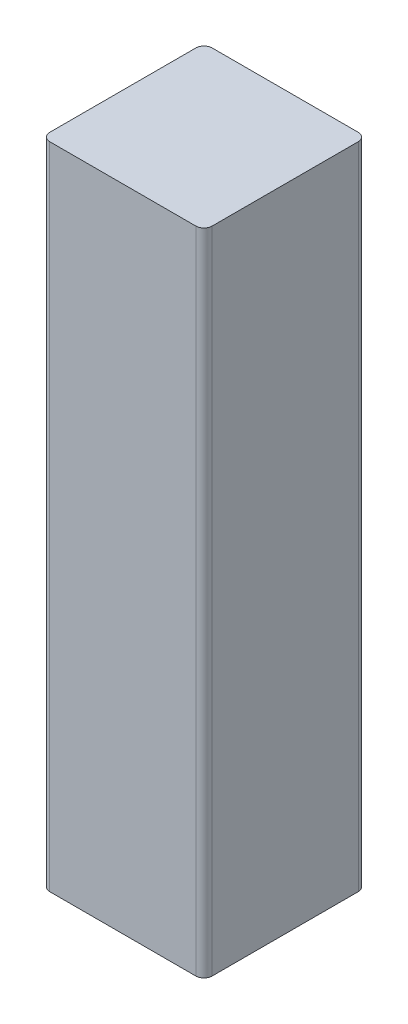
SolidWorks part; units mm, degrees
ref_plane "Plan de face" through (0, 0, 0) normal (0, 0, 1) x (1, 0, 0)
ref_plane "Plan de dessus" through (0, 0, 0) normal (0, 1, 0) x (1, 0, 0)
ref_plane "Plan de droite" through (0, 0, 0) normal (1, 0, 0) x (0, 0, -1)
ref_plane "Plan1" through (0, 20, 0) normal (0, 1, 0) x (1, 0, 0)
sketch "Esquisse1" plane through (0, 20, 0) normal (0, 1, 0) x (1, 0, 0)
  line L0 (-4.5, -5) -> (4.5, -5)
  line L1 (5, -4.5) -> (5, 4.5)
  line L2 (4.5, 5) -> (-4.5, 5)
  line L3 (-5, 4.5) -> (-5, -4.5)
  arc A0 (4.5, -5) -> (5, -4.5) centre (4.5, -4.5) ccw
  arc A1 (5, 4.5) -> (4.5, 5) centre (4.5, 4.5) ccw
  arc A2 (-4.5, 5) -> (-5, 4.5) centre (-4.5, 4.5) ccw
  arc A3 (-5, -4.5) -> (-4.5, -5) centre (-4.5, -4.5) ccw
extrude "Boss.-Extru.1" add sketch "Esquisse1" against normal blind 40
